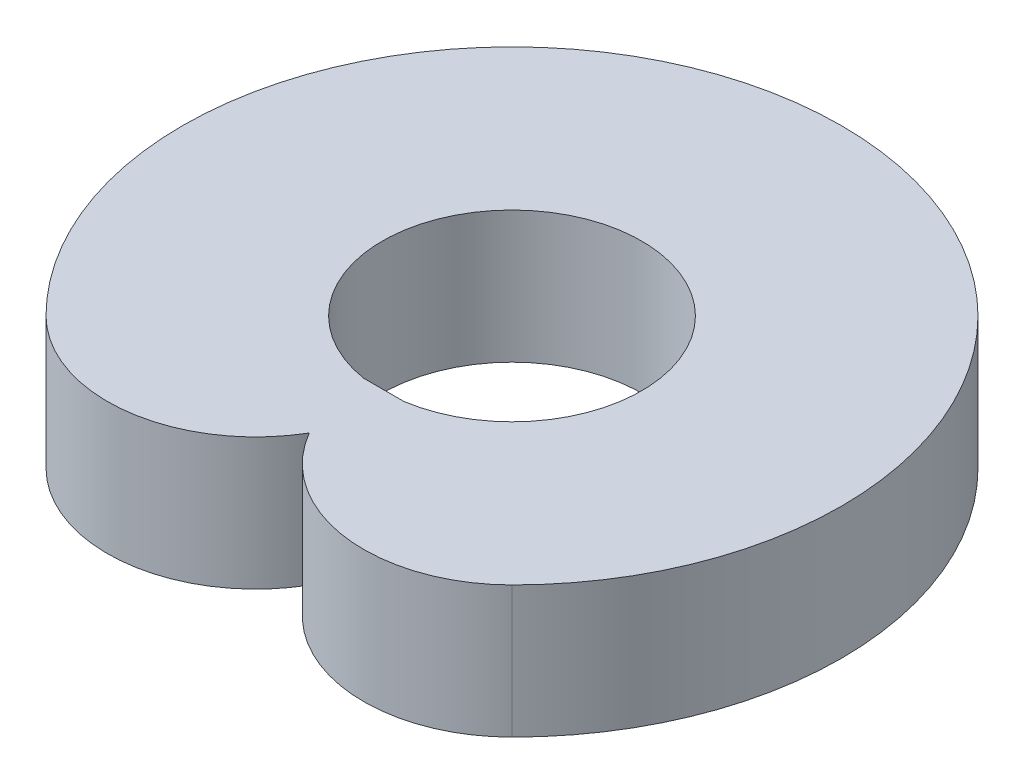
SolidWorks part; units mm, degrees
ref_plane "前视基准面" through (0, 0, 0) normal (0, 0, 1) x (1, 0, 0)
ref_plane "上视基准面" through (0, 0, 0) normal (0, 1, 0) x (1, 0, 0)
ref_plane "右视基准面" through (0, 0, 0) normal (1, 0, 0) x (0, 0, -1)
sketch "草图1" plane through (0, 0, 0) normal (0, 1, 0) x (1, 0, 0)
  line L0 (0, 0) -> (0, 825) construction
  line L1 (0, 0) -> (-707.1068, -707.1068) construction
  line L2 (0, 0) -> (707.1068, -707.1068) construction
  line L3 (0, 550) -> (318.1981, 231.8019) construction
  line L4 (0, 550) -> (-318.1981, 231.8019) construction
  line L5 (61.0913, -388.9087) -> (-61.0913, -388.9087)
  circle A0 centre (0, 0) radius 550 construction
  circle A1 centre (0, 550) radius 450 construction
  arc A2 (707.1068, -707.1068) -> (-707.1068, -707.1068) centre (0, 0) ccw
  arc A4 (-707.1068, -707.1068) -> (0, -615.2934) centre (-388.9087, -388.9087) ccw
  arc A5 (0, -615.2934) -> (707.1068, -707.1068) centre (388.9087, -388.9087) ccw
  arc A7 (61.0913, -388.9087) -> (-61.0913, -388.9087) centre (0, 0) ccw
  dimension "D1" = 1100
  dimension "D2" = 900
  dimension "D4" = 135
  dimension "D3" = 1000
  dimension "D8" = 135
  dimension "D5" = 135
  dimension "D6" = 135
  dimension "D7" = 135
extrude "凸台-拉伸1" add sketch "草图1" along normal blind 400
